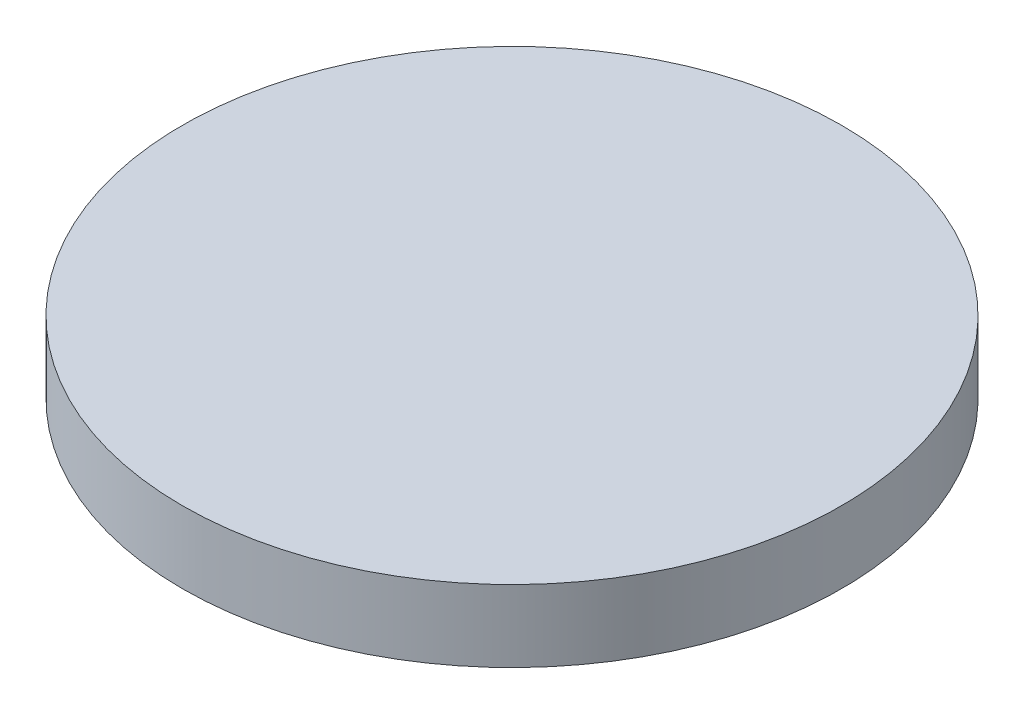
SolidWorks part; units mm, degrees
ref_plane "Front Plane" through (0, 0, 0) normal (0, 0, 1) x (1, 0, 0)
ref_plane "Top Plane" through (0, 0, 0) normal (0, 1, 0) x (1, 0, 0)
ref_plane "Right Plane" through (0, 0, 0) normal (1, 0, 0) x (0, 0, -1)
sketch "Sketch1" plane through (0, 0, 0) normal (0, 1, 0) x (1, 0, 0)
  circle A0 centre (0, 0) radius 13.97
  dimension "D1" = 27.94
extrude "Boss-Extrude1" add sketch "Sketch1" along normal blind 3.048
sketch "Sketch2" plane through (0, 0, 0) normal (0, -1, 0) x (1, 0, 0)
  circle A0 centre (0, 0) radius 8.001
  dimension "D1" = 16.002
extrude "Boss-Extrude2" add sketch "Sketch2" along normal blind 1.778
sketch "Sketch3" plane through (0, 0, 0) normal (0, -1, 0) x (1, 0, 0)
  circle A0 centre (0, 10.922) radius 1.5875
  dimension "D2" = 3.175
  dimension "D1" = 10.922
extrude "Cut-Extrude1" cut sketch "Sketch3" against normal blind 0.508
pattern_circular "CirPattern1" count 12 over 360 about axis through (0, 0, 0) along (0, 1, 0) of "Cut-Extrude1"
